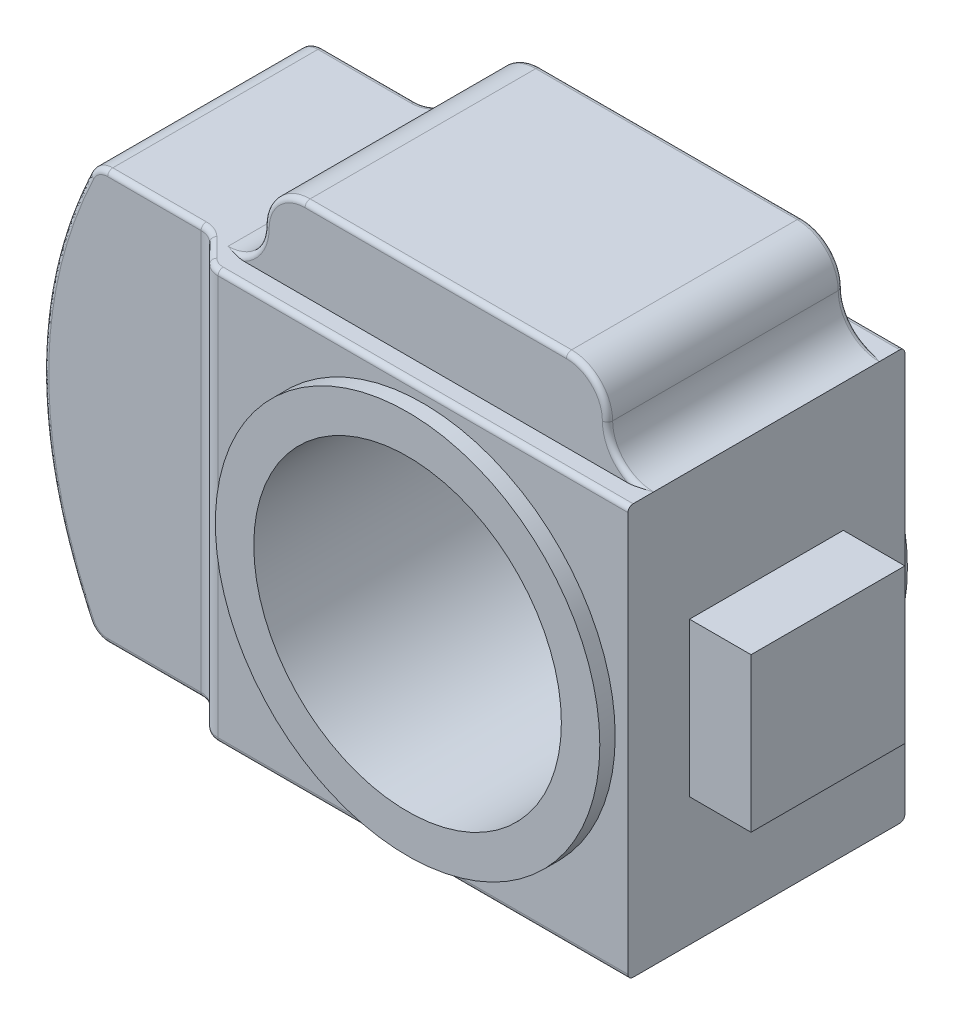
SolidWorks part; units mm, degrees
ref_plane "Płaszczyzna przednia" through (0, 0, 0) normal (0, 0, 1) x (1, 0, 0)
ref_plane "Płaszczyzna górna" through (0, 0, 0) normal (0, 1, 0) x (1, 0, 0)
ref_plane "Płaszczyzna prawa" through (0, 0, 0) normal (1, 0, 0) x (0, 0, -1)
sketch "Szkic1" plane through (0, 0, 0) normal (0, 0, 1) x (1, 0, 0)
  line L1 (-60, 40) -> (60, 40)
  line L2 (-60, 40) -> (-60, -40)
  line L3 (-60, -40) -> (60, -40)
  line L4 (60, 40) -> (60, -40)
  line L5 (-60, 40) -> (60, -40) construction
  line L6 (-60, -40) -> (60, 40) construction
  point P0 (0, 0)
  dimension "D1" = 80
  dimension "D2" = 120
extrude "Dodanie-wyciągnięcie1" add sketch "Szkic1" along normal blind 60
sketch "Szkic2" plane through (0, 0, 60) normal (0, 0, 1) x (1, 0, 0)
  circle A0 centre (20, 0) radius 30
  dimension "D1" = 20
extrude "Wytnij-wyciągnięcie1" cut sketch "Szkic2" against normal up to next
sketch "Szkic3" plane through (0, 0, 60) normal (0, 0, 1) x (1, 0, 0)
  line L1 (-60, 40) -> (60, 40)
  line L2 (-60, 40) -> (-60, -40)
  line L3 (-60, -40) -> (60, -40)
  line L4 (60, 40) -> (60, -40)
  line L5 (-60, 40) -> (60, -40) construction
  line L6 (-60, -40) -> (60, 40) construction
  circle A0 centre (20, 0) radius 37.5
  point P7 (0, 0)
  dimension "D1" = 75
extrude "Wytnij-wyciągnięcie2" cut sketch "Szkic3" against normal blind 3
ref_plane "Płaszczyzna1" through (0, 0, 30) normal (0, 0, 1) x (1, 0, 0)
mirror "Lustro1" about plane through (0, 0, 30) normal (0, 0, 1) of "Wytnij-wyciągnięcie2"
sketch "Szkic4" plane through (0, 0, 57) normal (0, 0, 1) x (1, 0, 0)
  line L0 (60, 40) -> (-60, 40) construction
  line L1 (-60, 40) -> (-60, -40) construction
  line L2 (-60, -40) -> (60, -40) construction
  line L3 (-50, 40) -> (-60, 40)
  line L4 (-60, 40) -> (-60, -40)
  line L5 (-60, -40) -> (-50, -40)
  spline S0 degree 2 poles (-50, 40) (-70, 0) (-50, -40) knots 0 0 0 1 1 1
  dimension "D1" = 10
  dimension "D2" = 10
extrude "Wytnij-wyciągnięcie5" cut sketch "Szkic4" against normal up to next contours S0 L4 L1 | S0 L4 L2
fillet "Zaokrąglenie1" radius 4 2 edges at (-50, -40, 30) (-50, 40, 30)
sketch "Szkic6" plane through (0, 40, 0) normal (0, 1, 0) x (1, 0, 0)
  line L0 (-21.6157, -3) -> (-27.6157, -9)
  line L1 (60, -3) -> (-47.4962, -3) construction
  line L2 (-27.6157, -9) -> (-60, -9)
  line L3 (-60, -3) -> (-60, -57) construction
  line L4 (-60, -9) -> (-60, -3)
  line L5 (-60, -3) -> (-21.6157, -3)
  line L6 (-60, -30) -> (59.9008, -30) construction
  line L7 (-44, -30) -> (44, -30) construction
  line L8 (-21.6157, -57) -> (-27.6157, -51)
  line L9 (-60, -57) -> (-21.6157, -57)
  line L10 (-60, -51) -> (-60, -57)
  line L11 (-27.6157, -51) -> (-60, -51)
  dimension "D1" = 6
  dimension "D2" = 6
extrude "Wytnij-wyciągnięcie6" cut sketch "Szkic6" against normal up to next
fillet "Zaokrąglenie2" radius 4 4 edges at (-21.6157, 0, 3) (-27.6157, 0, 9) (-21.6157, 0, 57) (-27.6157, 0, 51)
sketch "Szkic7" plane through (0, 40, 0) normal (0, 1, 0) x (1, 0, 0)
  line L0 (60, -3) -> (-19.9588, -3) construction
  line L1 (52, -53) -> (-15, -53)
  line L2 (52, -53) -> (52, -7)
  line L3 (52, -7) -> (-15, -7)
  line L4 (-15, -53) -> (-15, -7)
  line L5 (52, -53) -> (-15, -7) construction
  line L6 (52, -7) -> (-15, -53) construction
  line L7 (60, -57) -> (60, -3) construction
  line L8 (60, -57) -> (-19.9588, -57) construction
  point P4 (18.5, -30)
  dimension "D1" = 4
  dimension "D2" = 8
  dimension "D3" = 4
  dimension "D4" = 75
extrude "Dodanie-wyciągnięcie2" add sketch "Szkic7" along normal blind 16
fillet "Zaokrąglenie3" radius 8 4 edges at (52, 40, 30) (52, 56, 30) (-15, 56, 30) (-15, 40, 30)
sketch "Szkic8" plane through (60, 0, 0) normal (1, 0, 0) x (0, 0, -1)
  line L0 (-57, 40) -> (-3, -40) construction
  line L2 (-45, 15) -> (-15, 15)
  line L3 (-45, 15) -> (-45, -15)
  line L4 (-45, -15) -> (-15, -15)
  line L5 (-15, 15) -> (-15, -15)
  line L6 (-45, 15) -> (-15, -15) construction
  line L7 (-45, -15) -> (-15, 15) construction
  point P4 (-30, 0)
  dimension "D1" = 30
  dimension "D2" = 30
extrude "Dodanie-wyciągnięcie3" add sketch "Szkic8" along normal blind 12
fillet "Zaokrąglenie4" radius 1 26 edges at (20.0206, -40, 3) (-21.4896, -40, 3.3045) (-24.6157, -40, 6) (-27.7418, -40, 8.6955) (-38.3844, -40, 9) (-38.3844, 40, 9) (-27.7418, 40, 8.6955) (-24.6157, 40, 6) (-21.4896, 40, 3.3045) (20.0206, -40, 57) (-21.4896, -40, 56.6955) (-24.6157, -40, 54) (-27.7418, -40, 51.3045) (-38.3844, -40, 51) (-38.3844, 40, 51) (-27.7418, 40, 51.3045) (-24.6157, 40, 54) (-21.4896, 40, 56.6955) (20.0206, 40, 3) (20.0206, 40, 57)
fillet "Zaokrąglenie5" radius 1 10 edges at (54.3431, 42.3431, 7) (49.6569, 53.6569, 7) (-17.3431, 42.3431, 7) (-12.6569, 53.6569, 7) (-17.3431, 42.3431, 53) (-12.6569, 53.6569, 53) (54.3431, 42.3431, 53) (49.6569, 53.6569, 53) (18.5, 56, 7) (18.5, 56, 53)
